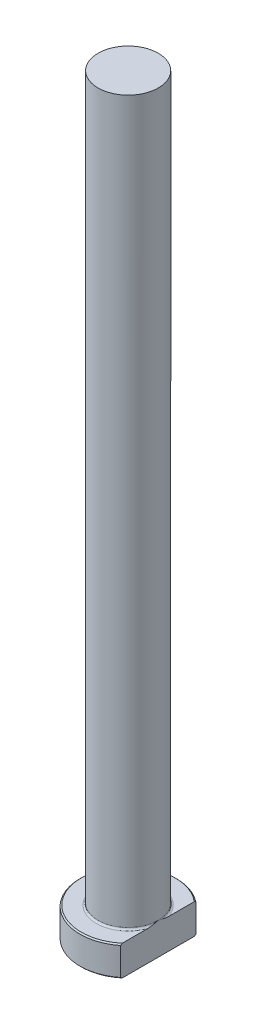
SolidWorks part; units mm, degrees
ref_plane "Front Plane" through (0, 0, 0) normal (0, 0, 1) x (1, 0, 0)
ref_plane "Top Plane" through (0, 0, 0) normal (0, 1, 0) x (1, 0, 0)
ref_plane "Right Plane" through (0, 0, 0) normal (1, 0, 0) x (0, 0, -1)
sketch "Sketch1" plane through (0, 0, 0) normal (0, 0, 1) x (1, 0, 0)
  line L0 (0, 259.9588) -> (0, -15.1925) construction
  line L1 (0, 0) -> (-8, 0)
  line L2 (-8, 0) -> (-8, 5)
  line L3 (-8, 5) -> (-5, 5)
  line L4 (-5, 5) -> (-5, 125)
  line L5 (-5, 125) -> (0, 125)
  line L6 (0, 125) -> (0, 0)
  dimension "L" = 125
  dimension "H" = 16
  dimension "T" = 5
  dimension "D" = 10
revolve "Revolve1" add sketch "Sketch1" angle 360 about L0
chamfer "Chamfer1" distance 0.2 angle 45 2 edges at (0, 5, 8) (0, 0, 8)
fillet "Fillet1" radius 0.3 1 edges at (0, 5, 5)
sketch "Sketch2" plane through (0, 0, 0) normal (0, 1, 0) x (1, 0, 0)
  line L0 (5, 6.245) -> (5, -6.245)
  circle A0 centre (0, 0) radius 8 construction
  arc A1 (5, -6.245) -> (5, 6.245) centre (0, 0) ccw
  circle A2 centre (0, 0) radius 5 construction
extrude "KEY" cut sketch "Sketch2" along normal through all
